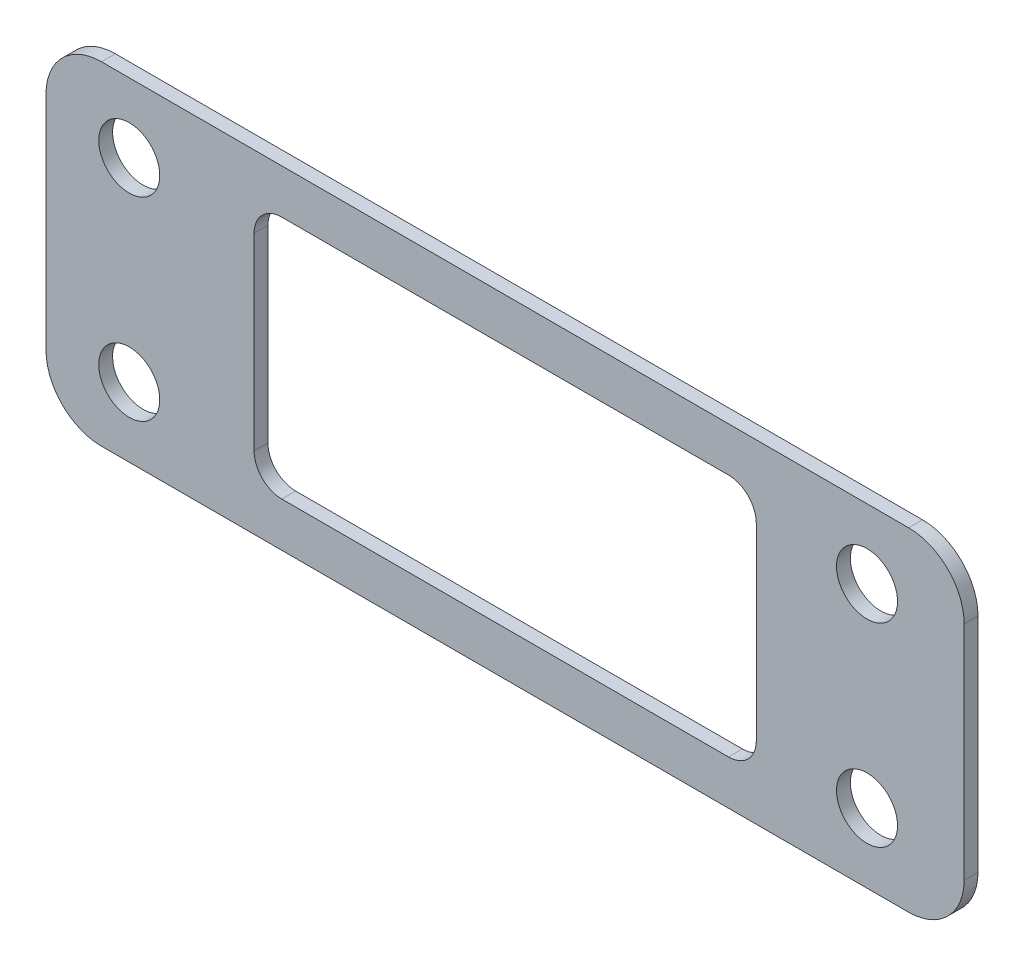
SolidWorks part; units mm, degrees
ref_plane "Płaszczyzna przednia" through (0, 0, 0) normal (0, 0, 1) x (1, 0, 0)
ref_plane "Płaszczyzna górna" through (0, 0, 0) normal (0, 1, 0) x (1, 0, 0)
ref_plane "Płaszczyzna prawa" through (0, 0, 0) normal (1, 0, 0) x (0, 0, -1)
sketch "Szkic1" plane through (0, 0, 0) normal (0, 1, 0) x (1, 0, 0)
  line L0 (758.8942, 1073.417) -> (758.8942, 1016.417) construction
  line L1 (8.8942, 1016.417) -> (8.8942, -1073.6548) construction
  line L2 (-846.1488, 1016.417) -> (846.1488, 1016.417) construction
  line L3 (758.8942, 1016.417) -> (8.8942, 266.417) construction
  dimension "D1" = 45
  dimension "D2" = 750
ref_plane "Płaszczyzna1" through (0, 0, -1016.417) normal (0, 0, 1) x (1, 0, 0)
ref_plane "Płaszczyzna2" through (8.8942, 0, 0) normal (-1, 0, 0) x (0, 0, 1)
sketch "Szkic3" plane through (0, 0, 0) normal (0, 1, 0) x (1, 0, 0)
  line L0 (874.155, 1237.7438) -> (-771.1848, -407.5961)
  line L2 (758.8942, 1016.417) -> (8.8942, 266.417) construction
  dimension "D1" = 75
sketch "Szkic4" plane through (0, 0, 0) normal (0, 1, 0) x (1, 0, 0)
  line L0 (487.9754, 1013.917) -> (818.8942, 1013.917)
  line L1 (11.3942, 557.3358) -> (11.3942, 66.417)
  line L2 (8.8942, 1016.417) -> (8.8942, -1073.6548) construction
  line L3 (-846.1488, 1016.417) -> (846.1488, 1016.417) construction
  dimension "D1" = 2.5
  dimension "D2" = 2.5
  dimension "D4" = 60
  dimension "D6" = 200
ref_plane "Płaszczyzna4" through (487.9754, 0, -1013.917) normal (1, 0, 0) x (0, 0, -1)
other "Blacha 120x5 - configured BLACHA 120X5(1)"
ref_plane "Płaszczyzna5" through (487.9754, 0, -1013.917) normal (1, 0, 0) x (0, 1, 0)
sketch "Szkic11" plane through (487.9754, 0, -1013.917) normal (1, 0, 0) x (0, 1, 0)
  line L1 (-60, 2.5) -> (60, 2.5)
  line L2 (-60, 2.5) -> (-60, -2.5)
  line L3 (-60, -2.5) -> (60, -2.5)
  line L4 (60, 2.5) -> (60, -2.5)
  line L5 (-60, 2.5) -> (60, -2.5) construction
  line L6 (-60, -2.5) -> (60, 2.5) construction
  point P0 (0, 0)
  point P6 (0, 0)
  dimension "D1" = 120
  dimension "D2" = 5
fillet "Zaokrąglenie2" radius 20 4 edges at (487.9754, 60, -1013.917) (487.9754, -60, -1013.917) (818.8942, 60, -1013.917) (818.8942, -60, -1013.917)
sketch "Szkic14" plane through (0, 0, -1016.417) normal (0, 0, -1) x (-1, 0, 0)
  line L2 (-487.9754, -40) -> (-487.9754, 40) construction
  line L3 (-818.8942, -40) -> (-818.8942, 40) construction
  circle A0 centre (-783.8942, 35) radius 11
  circle A2 centre (-783.8942, -35) radius 11
  circle A4 centre (-517.9754, 35) radius 11
  circle A5 centre (-517.9754, -35) radius 11
  dimension "D4" = 22
  dimension "D5" = 30
  dimension "D6" = 35
extrude "Wytnij-wyciągnięcie2" cut sketch "Szkic14" against normal blind 20
sketch "Szkic16" plane through (0, 0, -1016.417) normal (0, 0, -1) x (-1, 0, 0)
  line L0 (-487.9754, -40) -> (-487.9754, 40) construction
  line L1 (-743.9754, 44) -> (-562.9754, 44)
  line L2 (-743.9754, 44) -> (-743.9754, -44)
  line L3 (-743.9754, -44) -> (-562.9754, -44)
  line L4 (-562.9754, 44) -> (-562.9754, -44)
  line L5 (-743.9754, 44) -> (-562.9754, -44) construction
  line L6 (-743.9754, -44) -> (-562.9754, 44) construction
  point P4 (-653.4754, 0)
  dimension "D1" = 88
  dimension "D2" = 181
  dimension "D3" = 75
extrude "Wytnij-wyciągnięcie3" cut sketch "Szkic16" against normal blind 5
fillet "Zaokrąglenie3" radius 10 4 edges at (743.9754, 44, -1013.917) (743.9754, -44, -1013.917) (562.9754, 44, -1013.917) (562.9754, -44, -1013.917)
other "Zapisz obiekty1"
